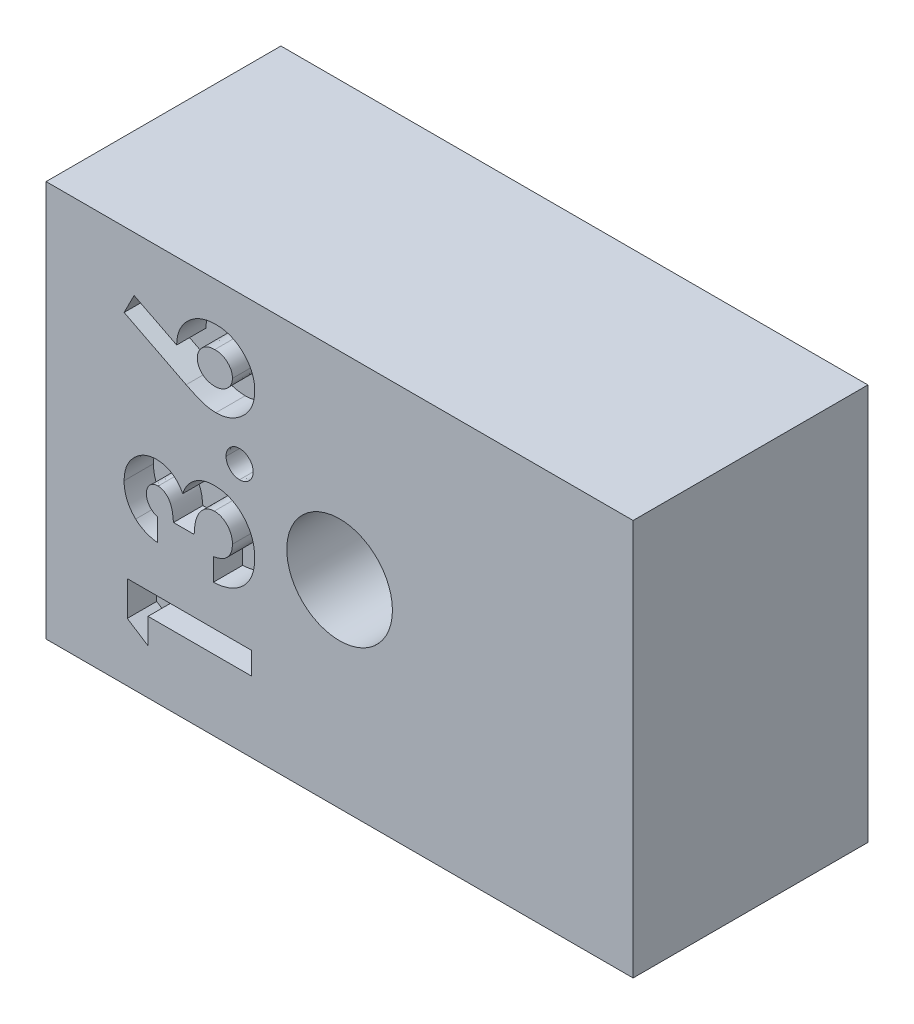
SolidWorks part; units mm, degrees
ref_plane "Front Plane" through (0, 0, 0) normal (0, 0, 1) x (1, 0, 0)
ref_plane "Top Plane" through (0, 0, 0) normal (0, 1, 0) x (1, 0, 0)
ref_plane "Right Plane" through (0, 0, 0) normal (1, 0, 0) x (0, 0, -1)
sketch "Sketch1" plane through (0, 0, 0) normal (0, 0, 1) x (1, 0, 0)
  line L1 (-12.2454, 6.5291) -> (7.7546, 6.5291)
  line L2 (-12.2454, 6.5291) -> (-12.2454, -6.9709)
  line L3 (-12.2454, -6.9709) -> (7.7546, -6.9709)
  line L4 (7.7546, 6.5291) -> (7.7546, -6.9709)
  circle A0 centre (-2.2454, -0.2209) radius 1.8
  dimension "D3" = 3.6
  dimension "D1" = 13.5
  dimension "D2" = 20
  dimension "D4" = 10
  dimension "D5" = 6.75
extrude "Boss-Extrude1" add sketch "Sketch1" along normal blind 8
ref_plane "Plane1" through (0, 0, 8) normal (0, 0, 1) x (1, 0, 0)
sketch "Sketch3" plane through (0, 0, 8) normal (0, 0, 1) x (1, 0, 0)
  line L0 (-5.2454, -6.9709) -> (-5.2454, 6.5291) construction
  line L1 (-12.2454, -6.9709) -> (7.7546, -6.9709) construction
  line L2 (7.7546, 6.5291) -> (-12.2454, 6.5291) construction
  line L3 (7.7546, -6.9709) -> (7.7546, 6.5291) construction
  text T0 "13.6  " font "Century Gothic" height in points 16
  dimension "D1" = 13
extrude "Cut-Extrude1" cut sketch "Sketch3" against normal blind 1
